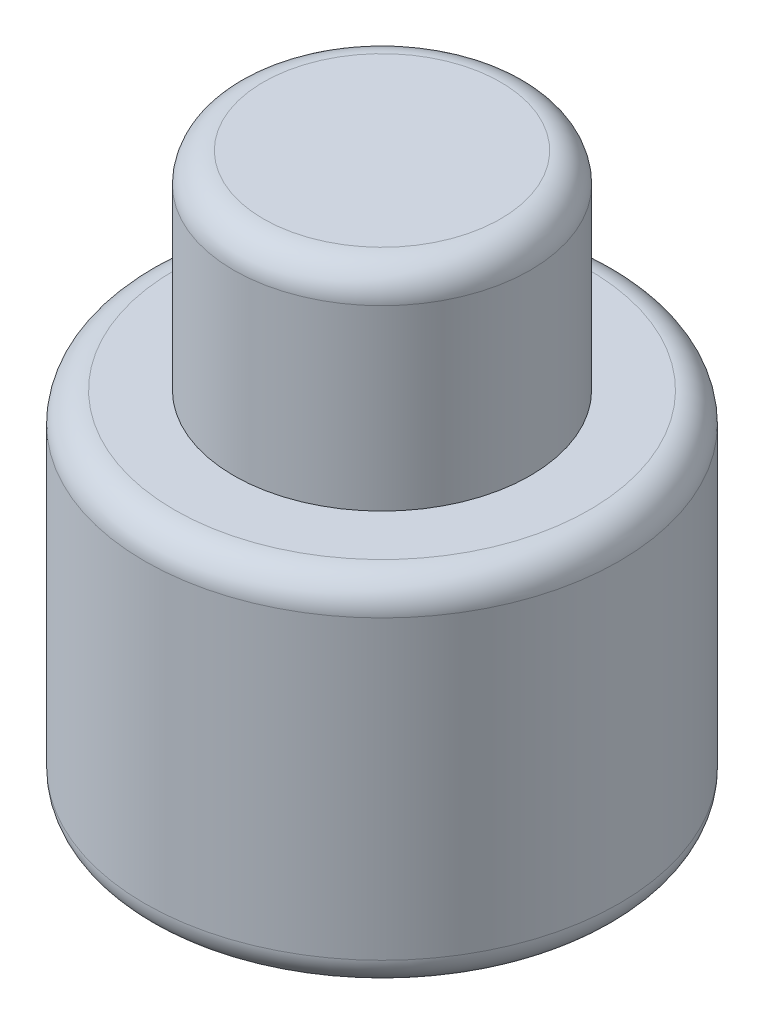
SolidWorks part; units mm, degrees
ref_plane "Plan de face" through (0, 0, 0) normal (0, 0, 1) x (1, 0, 0)
ref_plane "Plan de dessus" through (0, 0, 0) normal (0, 1, 0) x (1, 0, 0)
ref_plane "Plan de droite" through (0, 0, 0) normal (1, 0, 0) x (0, 0, -1)
sketch "Esquisse1" plane through (0, 0, 0) normal (0, 0, 1) x (1, 0, 0)
  line L0 (0, 0) -> (0, 9.5)
  line L1 (0, -55) -> (0, 55) construction
  line L2 (0, 9.5) -> (2.5, 9.5)
  line L3 (2.5, 9.5) -> (2.5, 6)
  line L4 (2.5, 6) -> (4, 6)
  line L5 (4, 6) -> (4, 0)
  line L6 (55, 0) -> (-55, 0) construction
  line L7 (4, 0) -> (0, 0)
  dimension "D1" = 2.5
  dimension "D2" = 4
  dimension "D3" = 3.5
  dimension "D4" = 6
revolve "Révolution1" add sketch "Esquisse1" angle 360 about L0
fillet "Congé1" radius 0.5 3 edges at (0, 0, -4) (0, 6, -4) (0, 9.5, -2.5)
